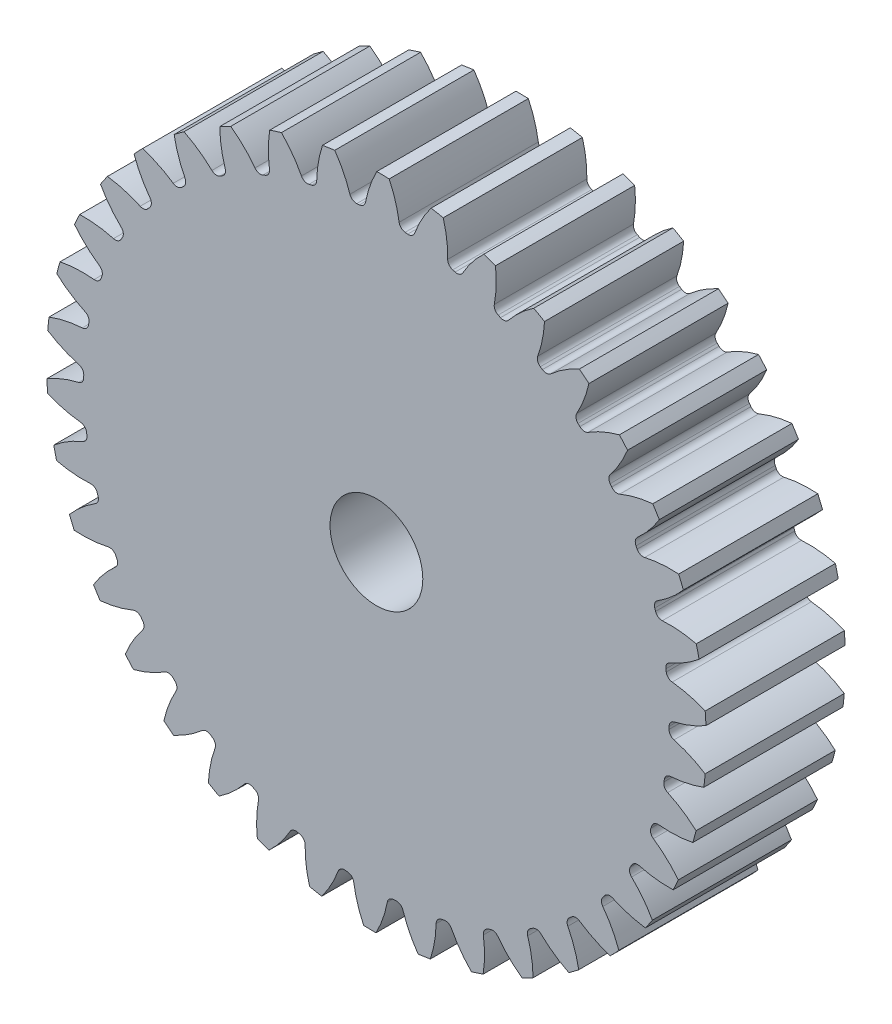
SolidWorks part; units mm, degrees
ref_plane "Front" through (0, 0, 0) normal (0, 0, 1) x (1, 0, 0)
ref_plane "Top" through (0, 0, 0) normal (0, 1, 0) x (1, 0, 0)
ref_plane "Right" through (0, 0, 0) normal (1, 0, 0) x (0, 0, -1)
sketch "Sketch3" plane through (0, 0, 0) normal (0, 0, 1) x (1, 0, 0)
  circle A0 centre (0, 0) radius 225.7778
  dimension "od" = 451.5556
extrude "gearBody" add sketch "Sketch3" along normal blind 95.25
sketch "Sketch2" plane through (0, 0, 0) normal (0, 0, 1) x (1, 0, 0)
  line L0 (0, 0) -> (186.2113, 77.1312) construction
  line L1 (225.1979, -19.0487) -> (0, 0) construction
  line L2 (0, 0) -> (36.3143, 0) construction
  line L3 (214.4404, 4.5627) -> (214.0887, -13.097) construction
  line L5 (214.2645, -4.2672) -> (0, 0) construction
  line L7 (0, 0) -> (201.5536, 0) construction
  arc A0 (201.5521, 0.7916) -> (201.3607, -8.8158) centre (0, 0) ccw construction
  arc A1 (225.5589, 9.9387) -> (224.9844, -18.9115) centre (0, 0) ccw construction
  arc A2 (214.4404, 4.5627) -> (214.0887, -13.097) centre (0, 0) ccw construction
  arc A3 (200.3184, -4.8784) -> (200.3538, -3.1012) centre (0, 0) ccw
  arc A4 (225.1979, -19.0487) -> (203.6903, -9.4196) centre (182.9926, -84.4841) ccw
  arc A5 (225.1979, -19.0487) -> (225.7778, 10.0673) centre (0, 0) ccw
  arc A6 (225.7778, 10.0673) -> (203.9038, 1.3021) centre (186.2113, 77.1312) cw
  arc A7 (200.3538, -3.1012) -> (203.9038, 1.3021) centre (204.9478, -3.1723) cw
  arc A8 (203.6903, -9.4196) -> (200.3184, -4.8784) centre (204.9116, -4.9903) cw
  point P6 (225.7778, 10.0673)
  point P22 (225.1979, -19.0487)
  dimension "baseDia" = 403.1073
  dimension "od" = 451.5556
  dimension "pd" = 428.9778
  dimension "rd" = 400.7556
  dimension "rFillet" = 4.5946
  dimension "pointX" = 225.7778
  dimension "pointY" = 10.0673
  dimension "CTT" = 17.6597
  dimension "flankCenterAngle" = 22.5
extrude "toothCut" cut sketch "Sketch2" along normal through all
pattern_circular "CirPattern1" count 38 over 360 about axis through (0, 0, 0) along (0, 0, 1) of "toothCut"
sketch "hub1Dia" plane through (0, 0, 0) normal (0, 0, -1) x (-1, 0, 0)
  circle A0 centre (0, 0) radius 12.7
  dimension "hub1Dia" = 25.4
sketch "hub2Dia" plane through (0, 0, 95.25) normal (0, 0, 1) x (1, 0, 0)
  circle A0 centre (0, 0) radius 12.7
  dimension "hub2dia" = 25.4
sketch "boreDia" plane through (0, 0, 0) normal (0, 0, 1) x (1, 0, 0)
  circle A0 centre (0, 0) radius 31.75
  dimension "boreDia" = 63.5
extrude "bore" cut sketch "boreDia" against normal mid plane 25400
